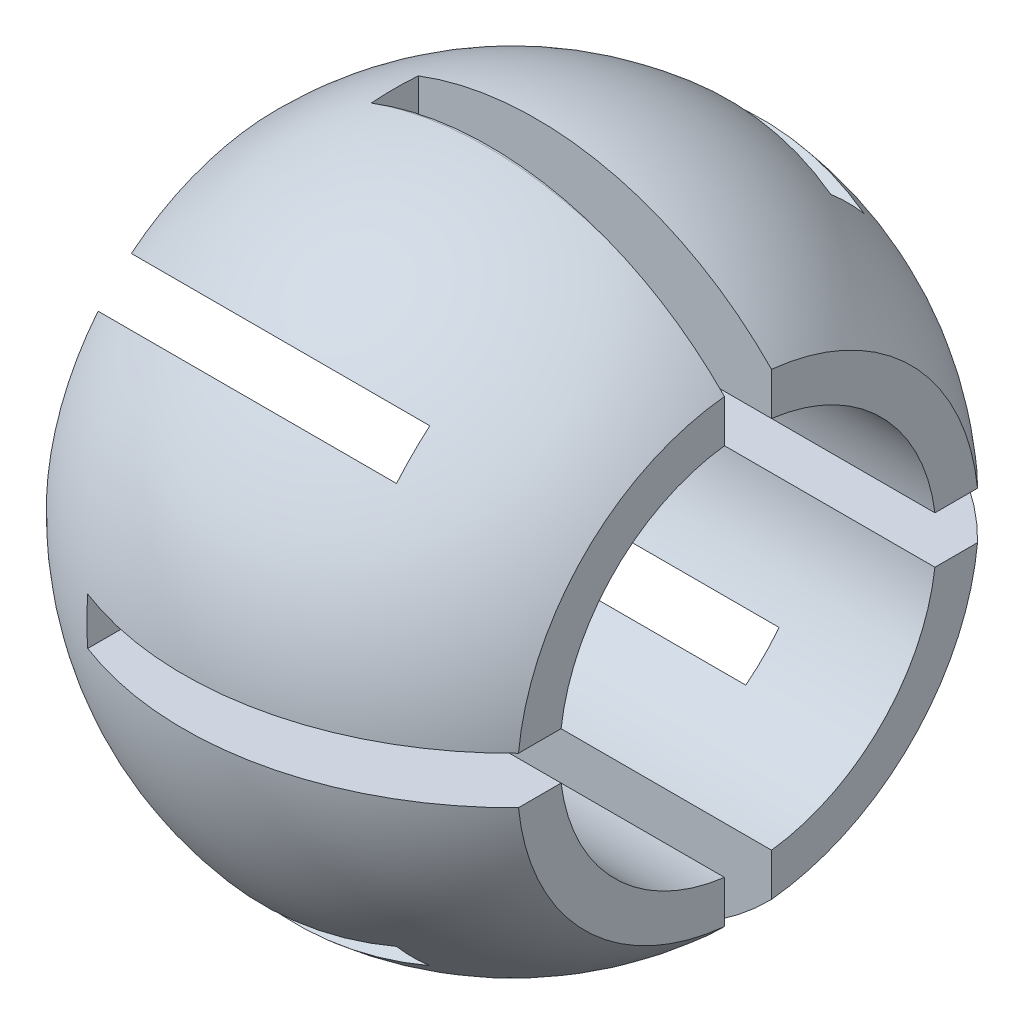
SolidWorks part; units mm, degrees
ref_plane "Vorne" through (0, 0, 0) normal (0, 0, 1) x (1, 0, 0)
ref_plane "Oben" through (0, 0, 0) normal (0, 1, 0) x (1, 0, 0)
ref_plane "Rechts" through (0, 0, 0) normal (1, 0, 0) x (0, 0, -1)
sketch "Skizze1" plane through (0, 0, 0) normal (0, 0, 1) x (1, 0, 0)
  line L0 (-5, 0) -> (5, 0) construction
  line L2 (-5, 4) -> (5, 4)
  line L4 (-5, 4) -> (-5, 4.899)
  line L6 (5, 4) -> (5, 4.899)
  arc A0 (5, 4.899) -> (-5, 4.899) centre (0, 0) ccw
  dimension "D1" = 14
  dimension "D2" = 10
  dimension "D3" = 8
revolve "Rotation1" add sketch "Skizze1" angle 360 about L0
sketch "Skizze2" plane through (0, 0, 0) normal (0, 1, 0) x (1, 0, 0)
  line L0 (5, -4.899) -> (5, 4.899) construction
  line L1 (-2.5, 0.5) -> (5, 0.5)
  line L2 (-2.5, 0.5) -> (-2.5, -0.5)
  line L3 (-2.5, -0.5) -> (5, -0.5)
  line L4 (5, 0.5) -> (5, -0.5)
  dimension "D1" = 0.5
  dimension "D2" = 1
  dimension "D3" = 7.5
extrude "Linear austragen1" cut sketch "Skizze2" against normal through all
pattern_circular "Kreismuster1" count 4 over 360 of "Linear austragen1"
ref_plane "Ebene1" through (0, 0, 0) normal (0, 0.7071, 0.7071) x (-1, 0, 0)
sketch "Skizze3" plane through (0, 0, 0) normal (0, 0.7071, 0.7071) x (-1, 0, 0)
  line L0 (5, -4.899) -> (5, 4.899) construction
  line L1 (5, 0.5) -> (-2.5, 0.5)
  line L2 (5, 0.5) -> (5, -0.5)
  line L3 (5, -0.5) -> (-2.5, -0.5)
  line L4 (-2.5, 0.5) -> (-2.5, -0.5)
  line L5 (-5, 0) -> (2.5, 0) construction
  dimension "D1" = 0.5
  dimension "D2" = 1
  dimension "D3" = 7.5
extrude "Linear austragen2" cut sketch "Skizze3" against normal through all
pattern_circular "Kreismuster2" count 4 over 360 of "Linear austragen2"
